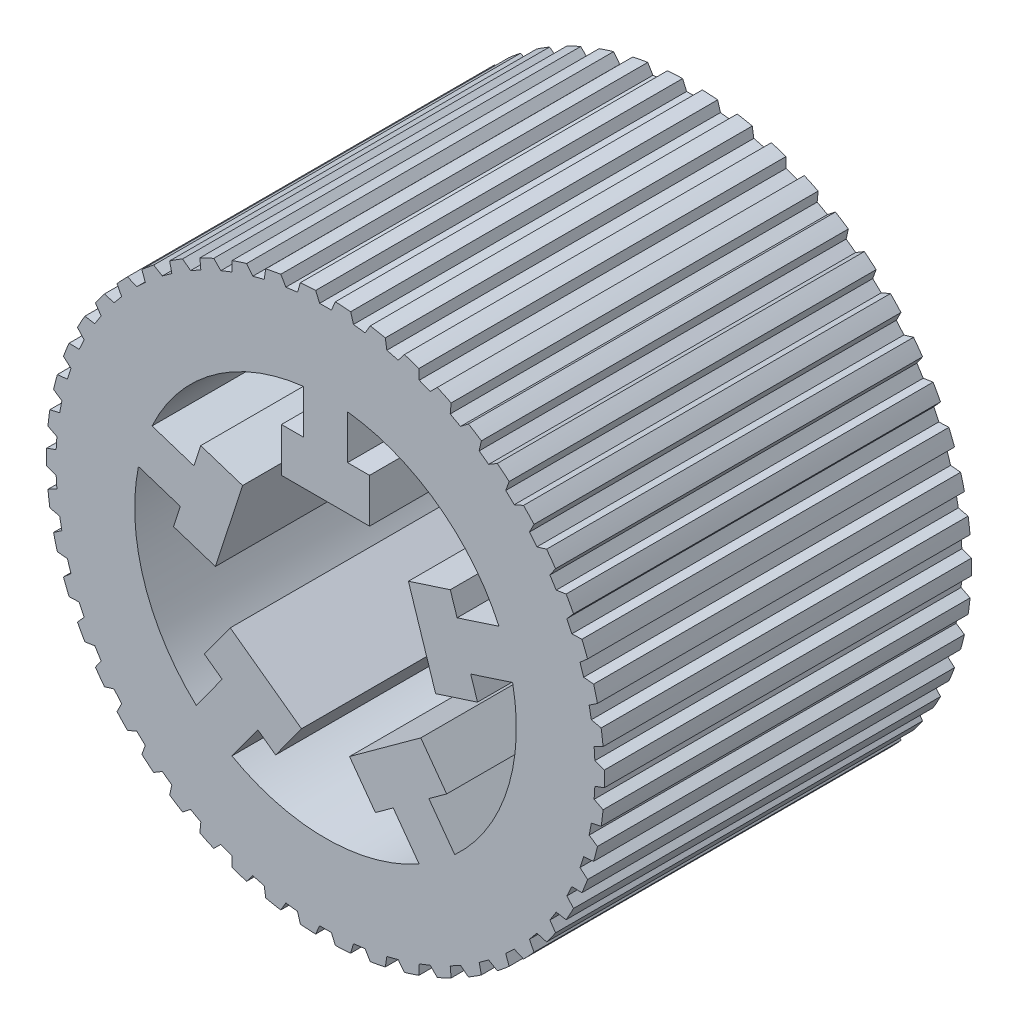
SolidWorks part; units mm, degrees
ref_plane "Front Plane" through (0, 0, 0) normal (0, 0, 1) x (1, 0, 0)
ref_plane "Top Plane" through (0, 0, 0) normal (0, 1, 0) x (1, 0, 0)
ref_plane "Right Plane" through (0, 0, 0) normal (1, 0, 0) x (0, 0, -1)
sketch "Sketch1" plane through (0, 0, 0) normal (0, 0, 1) x (1, 0, 0)
  circle A0 centre (0, 0) radius 13
  circle A1 centre (0, 0) radius 19
  dimension "D1" = 38
  dimension "D2" = 26
extrude "Boss-Extrude1" add sketch "Sketch1" along normal blind 25
sketch "Sketch2" plane through (0, 0, 25) normal (0, 0, 1) x (1, 0, 0)
  line L0 (-1.5, 12.9132) -> (-1.5, 9.9132)
  line L1 (-1.5, 9.9132) -> (-3, 9.9132)
  line L2 (-3, 9.9132) -> (-3, 6.9132)
  line L3 (-3, 6.9132) -> (3, 6.9132)
  line L4 (3, 6.9132) -> (3, 9.9132)
  line L5 (3, 9.9132) -> (1.5, 9.9132)
  line L6 (1.5, 9.9132) -> (1.5, 12.9132)
  line L7 (0, 20.3747) -> (0, -6.6363) construction
  line L8 (0, -13.75) -> (0, 13.75) construction
  circle A0 centre (0, 0) radius 13 construction
  arc A1 (-1.5, 12.9132) -> (1.5, 12.9132) centre (0, 0) cw
  dimension "D1" = 3
  dimension "D2" = 6
  dimension "D3" = 3
  dimension "D4" = 6
extrude "Boss-Extrude2" add sketch "Sketch2" against normal up to surface (25 mm away)
pattern_circular "CirPattern1" count 5 over 360 about axis through (0, 0, 0) along (0, 0, 1) of "Boss-Extrude2"
sketch "Sketch4" plane through (0, 0, 25) normal (0, 0, 1) x (1, 0, 0)
  line L0 (0, 20.2111) -> (0, 15.774) construction
  line L1 (0, -13.75) -> (0, 13.75) construction
  line L2 (-0.6716, 18.9881) -> (-0.4003, 18.3599)
  line L3 (-0.4003, 18.3599) -> (0.4003, 18.3599)
  line L4 (0.4003, 18.3599) -> (0.6716, 18.9881)
  circle A0 centre (0, 0) radius 19
  circle A1 centre (0, 0) radius 19 construction
  point P12 (0, 0)
  point P15 (0, 0)
extrude "Cut-Extrude1" cut sketch "Sketch4" against normal through all both and the other way through all contours L0 A0 L2 L3 | L0 L3 L4 M3
pattern_circular "CirPattern2" count 50 over 360 about axis through (0, 0, 0) along (0, 0, 1) of "Cut-Extrude1"
